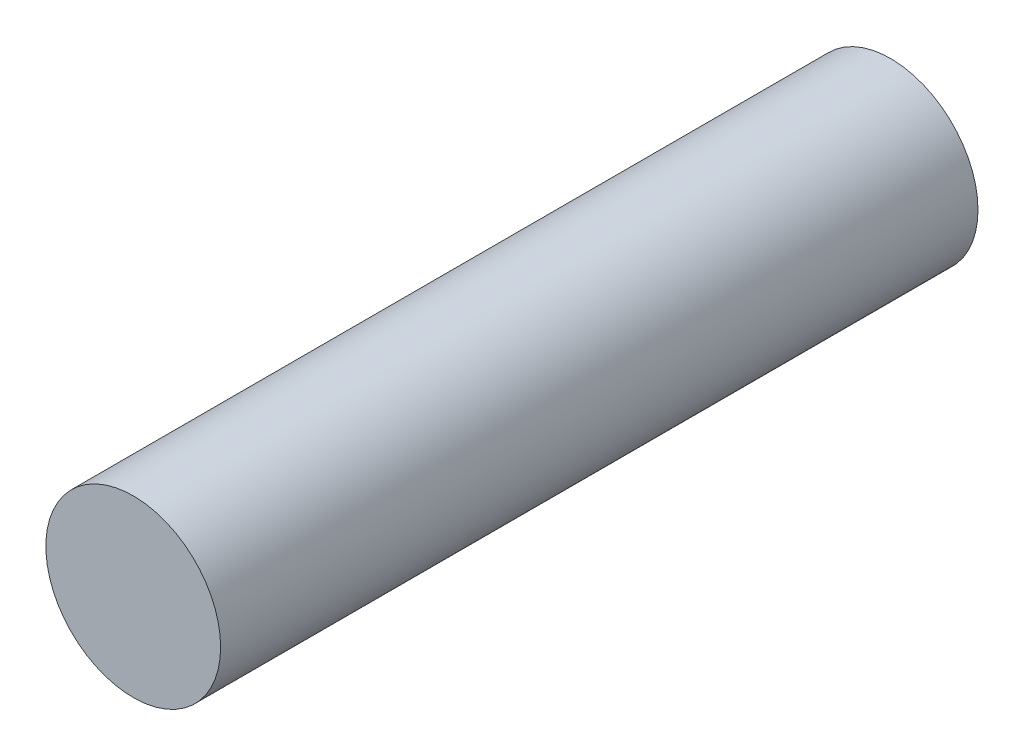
SolidWorks part; units mm, degrees
ref_plane "Front Plane" through (0, 0, 0) normal (0, 0, 1) x (1, 0, 0)
ref_plane "Top Plane" through (0, 0, 0) normal (0, 1, 0) x (1, 0, 0)
ref_plane "Right Plane" through (0, 0, 0) normal (1, 0, 0) x (0, 0, -1)
sketch "Sketch1" plane through (0, 0, 0) normal (0, 0, 1) x (1, 0, 0)
  circle A0 centre (0, 0) radius 0.6477
extrude "Boss-Extrude1" add sketch "Sketch1" along normal blind 5.6134
